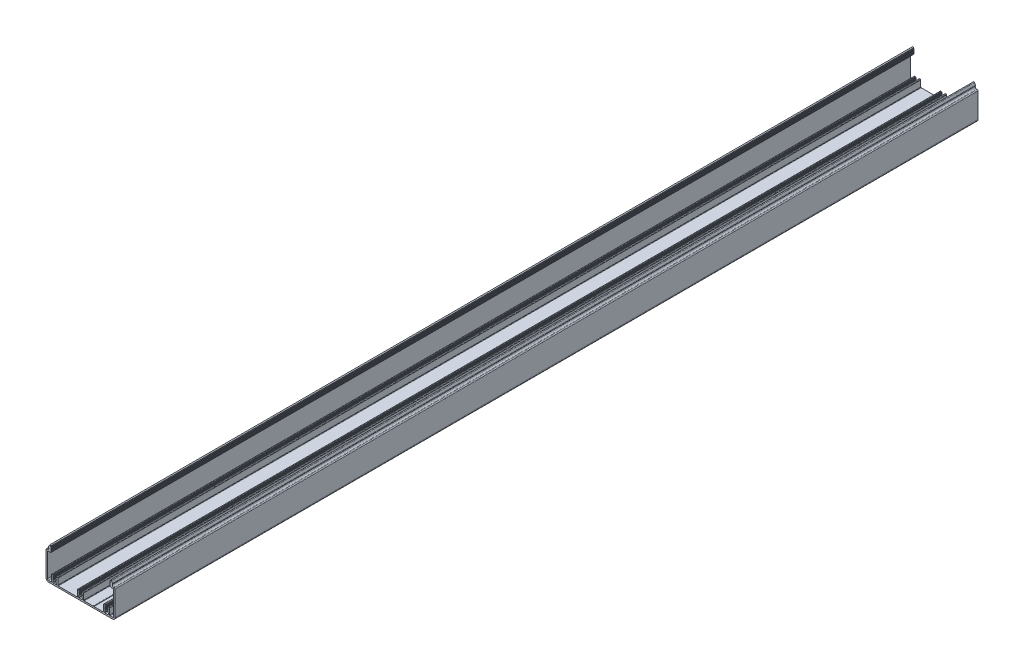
SolidWorks part; units mm, degrees
ref_plane "Ebene vorne" through (0, 0, 0) normal (0, 0, 1) x (1, 0, 0)
ref_plane "Ebene oben" through (0, 0, 0) normal (0, 1, 0) x (1, 0, 0)
ref_plane "Ebene rechts" through (0, 0, 0) normal (1, 0, 0) x (0, 0, -1)
sketch "Model" plane through (0, 0, 0) normal (0, 0, 1) x (1, 0, 0)
  line L0 (137.0091, -31.8859) -> (137.5591, -32.2034)
  line L1 (137.5591, -32.2034) -> (137.5591, -32.9684)
  line L2 (137.5591, -32.9684) -> (137.0091, -33.2859)
  line L3 (137.0091, -33.2859) -> (137.5591, -33.6034)
  line L4 (137.5591, -33.6034) -> (137.5591, -34.3684)
  line L5 (137.5591, -34.3684) -> (137.0091, -34.6859)
  line L6 (137.0091, -34.6859) -> (137.5591, -35.0034)
  line L7 (137.5591, -35.0034) -> (137.5591, -35.7683)
  line L8 (137.5591, -35.7683) -> (137.0091, -36.0859)
  line L9 (137.0091, -36.0859) -> (137.5591, -36.4034)
  line L10 (137.5591, -36.4034) -> (137.5591, -37.1683)
  line L11 (137.5591, -37.1683) -> (137.0091, -37.4859)
  line L12 (137.0091, -37.4859) -> (137.0091, -39.0359)
  line L13 (140.7591, -32.0359) -> (140.7591, -32.2684)
  line L14 (140.7591, -32.2684) -> (141.3091, -32.5859)
  line L15 (141.3091, -32.5859) -> (140.7591, -32.9034)
  line L16 (140.7591, -32.9034) -> (140.7591, -33.6684)
  line L17 (140.7591, -33.6684) -> (141.3091, -33.9859)
  line L18 (141.3091, -33.9859) -> (140.7591, -34.3034)
  line L19 (140.7591, -34.3034) -> (140.7591, -35.0683)
  line L20 (140.7591, -35.0683) -> (141.3091, -35.3859)
  line L21 (141.3091, -35.3859) -> (140.7591, -35.7034)
  line L22 (140.7591, -35.7034) -> (140.7591, -36.4683)
  line L23 (140.7591, -36.4683) -> (141.3091, -36.7859)
  line L24 (141.3091, -36.7859) -> (140.7591, -37.1034)
  line L25 (140.7591, -37.1034) -> (140.7591, -37.8683)
  line L26 (140.7591, -37.8683) -> (141.3091, -38.1859)
  line L27 (141.3091, -38.1859) -> (141.3091, -39.0359)
  line L28 (135.5091, -32.0359) -> (135.5091, -39.0359)
  line L29 (142.8091, -32.0359) -> (142.8091, -39.0359)
  line L30 (136.0091, -31.5359) -> (137.0091, -31.5359)
  line L31 (141.2591, -31.5359) -> (142.3091, -31.5359)
  line L32 (137.0091, -31.8859) -> (137.0091, -31.5359)
  line L33 (107.0091, -31.8859) -> (107.5591, -32.2034)
  line L34 (107.5591, -32.2034) -> (107.5591, -32.9684)
  line L35 (107.5591, -32.9684) -> (107.0091, -33.2859)
  line L36 (107.0091, -33.2859) -> (107.5591, -33.6034)
  line L37 (107.5591, -33.6034) -> (107.5591, -34.3684)
  line L38 (107.5591, -34.3684) -> (107.0091, -34.6859)
  line L39 (107.0091, -34.6859) -> (107.5591, -35.0034)
  line L40 (107.5591, -35.0034) -> (107.5591, -35.7683)
  line L41 (107.5591, -35.7683) -> (107.0091, -36.0859)
  line L42 (107.0091, -36.0859) -> (107.5591, -36.4034)
  line L43 (107.5591, -36.4034) -> (107.5591, -37.1683)
  line L44 (107.5591, -37.1683) -> (107.0091, -37.4859)
  line L45 (107.0091, -37.4859) -> (107.0091, -39.0359)
  line L46 (110.7591, -32.0359) -> (110.7591, -32.2684)
  line L47 (110.7591, -32.2684) -> (111.3091, -32.5859)
  line L48 (111.3091, -32.5859) -> (110.7591, -32.9034)
  line L49 (110.7591, -32.9034) -> (110.7591, -33.6684)
  line L50 (110.7591, -33.6684) -> (111.3091, -33.9859)
  line L51 (111.3091, -33.9859) -> (110.7591, -34.3034)
  line L52 (110.7591, -34.3034) -> (110.7591, -35.0683)
  line L53 (110.7591, -35.0683) -> (111.3091, -35.3859)
  line L54 (111.3091, -35.3859) -> (110.7591, -35.7034)
  line L55 (110.7591, -35.7034) -> (110.7591, -36.4683)
  line L56 (110.7591, -36.4683) -> (111.3091, -36.7859)
  line L57 (111.3091, -36.7859) -> (110.7591, -37.1034)
  line L58 (110.7591, -37.1034) -> (110.7591, -37.8683)
  line L59 (110.7591, -37.8683) -> (111.3091, -38.1859)
  line L60 (111.3091, -38.1859) -> (111.3091, -39.0359)
  line L61 (107.5091, -39.5359) -> (110.8091, -39.5359)
  line L62 (105.5091, -32.0359) -> (105.5091, -39.0359)
  line L63 (112.8091, -32.0359) -> (112.8091, -39.0359)
  line L64 (106.0091, -31.5359) -> (107.0091, -31.5359)
  line L65 (111.2591, -31.5359) -> (112.3091, -31.5359)
  line L66 (107.0091, -31.8859) -> (107.0091, -31.5359)
  line L67 (173.6658, -4.2821) -> (173.6658, -3.7877)
  line L68 (175.0687, -3.4118) -> (176.2252, -5.4148)
  line L69 (177.5091, -8.8359) -> (178.1591, -8.8359)
  line L70 (171.3091, -31.8859) -> (170.7591, -32.2034)
  line L71 (170.7591, -32.2034) -> (170.7591, -32.9684)
  line L72 (170.7591, -32.9684) -> (171.3091, -33.2859)
  line L73 (171.3091, -33.2859) -> (170.7591, -33.6034)
  line L74 (170.7591, -33.6034) -> (170.7591, -34.3684)
  line L75 (170.7591, -34.3684) -> (171.3091, -34.6859)
  line L76 (171.3091, -34.6859) -> (170.7591, -35.0034)
  line L77 (170.7591, -35.0034) -> (170.7591, -35.7683)
  line L78 (170.7591, -35.7683) -> (171.3091, -36.0859)
  line L79 (171.3091, -36.0859) -> (170.7591, -36.4034)
  line L80 (170.7591, -36.4034) -> (170.7591, -37.1683)
  line L81 (170.7591, -37.1683) -> (171.3091, -37.4859)
  line L82 (171.3091, -37.4859) -> (171.3091, -39.0359)
  line L83 (167.5591, -32.0359) -> (167.5591, -32.2684)
  line L84 (167.5591, -32.2684) -> (167.0091, -32.5859)
  line L85 (167.0091, -32.5859) -> (167.5591, -32.9034)
  line L86 (167.5591, -32.9034) -> (167.5591, -33.6684)
  line L87 (167.5591, -33.6684) -> (167.0091, -33.9859)
  line L88 (167.0091, -33.9859) -> (167.5591, -34.3034)
  line L89 (167.5591, -34.3034) -> (167.5591, -35.0683)
  line L90 (167.5591, -35.0683) -> (167.0091, -35.3859)
  line L91 (167.0091, -35.3859) -> (167.5591, -35.7034)
  line L92 (167.5591, -35.7034) -> (167.5591, -36.4683)
  line L93 (167.5591, -36.4683) -> (167.0091, -36.7859)
  line L94 (167.0091, -36.7859) -> (167.5591, -37.1034)
  line L95 (167.5591, -37.1034) -> (167.5591, -37.8683)
  line L96 (167.5591, -37.8683) -> (167.0091, -38.1859)
  line L97 (167.0091, -38.1859) -> (167.0091, -39.0359)
  line L98 (170.8091, -39.5359) -> (167.5091, -39.5359)
  line L99 (172.8091, -32.0359) -> (172.8091, -39.0359)
  line L100 (165.5091, -32.0359) -> (165.5091, -39.0359)
  line L101 (172.3091, -31.5359) -> (171.3091, -31.5359)
  line L102 (167.0591, -31.5359) -> (166.0091, -31.5359)
  line L103 (171.3091, -31.8859) -> (171.3091, -31.5359)
  line L104 (173.66, -9.8864) -> (173.1091, -9.5684)
  line L105 (173.1091, -9.5684) -> (173.1091, -8.8034)
  line L106 (173.1091, -8.8034) -> (173.6591, -8.4859)
  line L107 (173.6591, -8.4859) -> (173.1091, -8.1684)
  line L108 (173.1091, -8.1684) -> (173.1091, -7.4034)
  line L109 (173.1091, -7.4034) -> (173.6591, -7.0859)
  line L110 (173.6591, -7.0859) -> (173.1091, -6.7684)
  line L111 (173.1091, -6.7684) -> (173.1091, -6.0035)
  line L112 (173.1091, -6.0035) -> (173.6591, -5.6859)
  line L113 (173.6591, -5.6859) -> (173.1091, -5.3684)
  line L114 (173.1091, -5.3684) -> (173.1091, -4.6035)
  line L115 (102.1591, -41.3359) -> (176.1591, -41.3359)
  line L116 (99.1591, -9.8359) -> (99.1591, -38.3359)
  line L117 (100.9591, -38.3359) -> (100.9591, -10.8359)
  line L118 (179.1591, -9.8359) -> (179.1591, -38.3359)
  line L119 (177.3591, -38.3359) -> (177.3591, -10.8359)
  line L120 (176.1591, -39.5359) -> (173.3091, -39.5359)
  line L121 (135.0091, -39.5359) -> (113.3091, -39.5359)
  line L122 (105.0091, -39.5359) -> (102.1591, -39.5359)
  line L123 (104.6582, -9.8864) -> (105.2091, -9.5684)
  line L124 (105.2091, -9.5684) -> (105.2091, -8.8034)
  line L125 (105.2091, -8.8034) -> (104.6591, -8.4859)
  line L126 (104.6591, -8.4859) -> (105.2091, -8.1684)
  line L127 (105.2091, -8.1684) -> (105.2091, -7.4034)
  line L128 (105.2091, -7.4034) -> (104.6591, -7.0859)
  line L129 (104.6591, -7.0859) -> (105.2091, -6.7684)
  line L130 (105.2091, -6.7684) -> (105.2091, -6.0034)
  line L131 (105.2091, -6.0034) -> (104.6591, -5.6859)
  line L132 (104.6591, -5.6859) -> (105.2091, -5.3684)
  line L133 (105.2091, -5.3684) -> (105.2091, -4.6034)
  line L134 (105.2091, -4.6034) -> (104.6525, -4.2821)
  line L135 (104.6582, -9.8864) -> (104.658, -10.3359)
  line L136 (104.658, -10.3359) -> (101.4591, -10.3359)
  line L137 (173.66, -9.8864) -> (173.6602, -10.3359)
  line L138 (173.6602, -10.3359) -> (176.8591, -10.3359)
  line L139 (104.6525, -4.2821) -> (104.6525, -3.7877)
  line L140 (103.2495, -3.4118) -> (102.0931, -5.4148)
  line L141 (100.8091, -8.8359) -> (100.1591, -8.8359)
  line L142 (173.1091, -4.6035) -> (173.6658, -4.2821)
  line L143 (137.5091, -39.5359) -> (140.8091, -39.5359)
  line L144 (143.3091, -39.5359) -> (153.8127, -39.5359)
  line L145 (154.5055, -39.5359) -> (165.0091, -39.5359)
  arc A0 (137.0091, -39.0359) -> (137.5091, -39.5359) centre (137.5091, -39.0359) ccw
  arc A1 (140.8091, -39.5359) -> (141.3091, -39.0359) centre (140.8091, -39.0359) ccw
  arc A2 (135.0091, -39.5359) -> (135.5091, -39.0359) centre (135.0091, -39.0359) ccw
  arc A3 (142.8091, -32.0359) -> (142.3091, -31.5359) centre (142.3091, -32.0359) ccw
  arc A4 (142.8091, -39.0359) -> (143.3091, -39.5359) centre (143.3091, -39.0359) ccw
  arc A5 (136.0091, -31.5359) -> (135.5091, -32.0359) centre (136.0091, -32.0359) ccw
  arc A6 (141.2591, -31.5359) -> (140.7591, -32.0359) centre (141.2591, -32.0359) ccw
  arc A7 (107.0091, -39.0359) -> (107.5091, -39.5359) centre (107.5091, -39.0359) ccw
  arc A8 (110.8091, -39.5359) -> (111.3091, -39.0359) centre (110.8091, -39.0359) ccw
  arc A9 (105.0091, -39.5359) -> (105.5091, -39.0359) centre (105.0091, -39.0359) ccw
  arc A10 (112.8091, -32.0359) -> (112.3091, -31.5359) centre (112.3091, -32.0359) ccw
  arc A11 (112.8091, -39.0359) -> (113.3091, -39.5359) centre (113.3091, -39.0359) ccw
  arc A12 (106.0091, -31.5359) -> (105.5091, -32.0359) centre (106.0091, -32.0359) ccw
  arc A13 (111.2591, -31.5359) -> (110.7591, -32.0359) centre (111.2591, -32.0359) ccw
  arc A14 (176.2023, -6.4525) -> (176.2252, -5.4148) centre (175.3591, -5.9148) ccw
  arc A15 (176.2023, -6.4525) -> (177.5091, -8.8359) centre (177.5091, -7.2859) ccw
  arc A16 (179.1591, -9.8359) -> (178.1591, -8.8359) centre (178.1591, -9.8359) ccw
  arc A17 (170.8091, -39.5359) -> (171.3091, -39.0359) centre (170.8091, -39.0359) ccw
  arc A18 (167.0091, -39.0359) -> (167.5091, -39.5359) centre (167.5091, -39.0359) ccw
  arc A19 (172.8091, -39.0359) -> (173.3091, -39.5359) centre (173.3091, -39.0359) ccw
  arc A20 (166.0091, -31.5359) -> (165.5091, -32.0359) centre (166.0091, -32.0359) ccw
  arc A21 (165.0091, -39.5359) -> (165.5091, -39.0359) centre (165.0091, -39.0359) ccw
  arc A22 (172.8091, -32.0359) -> (172.3091, -31.5359) centre (172.3091, -32.0359) ccw
  arc A23 (167.5591, -32.0359) -> (167.0591, -31.5359) centre (167.0591, -32.0359) ccw
  arc A24 (100.9591, -38.3359) -> (102.1591, -39.5359) centre (102.1591, -38.3359) ccw
  arc A25 (101.4591, -10.3359) -> (100.9591, -10.8359) centre (101.4591, -10.8359) ccw
  arc A26 (176.1591, -39.5359) -> (177.3591, -38.3359) centre (176.1591, -38.3359) ccw
  arc A27 (177.3591, -10.8359) -> (176.8591, -10.3359) centre (176.8591, -10.8359) ccw
  arc A28 (99.1591, -38.3359) -> (102.1591, -41.3359) centre (102.1591, -38.3359) ccw
  arc A29 (176.1591, -41.3359) -> (179.1591, -38.3359) centre (176.1591, -38.3359) ccw
  arc A30 (102.0931, -5.4148) -> (102.116, -6.4525) centre (102.9591, -5.9148) ccw
  arc A31 (100.8091, -8.8359) -> (102.116, -6.4525) centre (100.8091, -7.2859) ccw
  arc A32 (100.1591, -8.8359) -> (99.1591, -9.8359) centre (100.1591, -9.8359) ccw
  arc A33 (175.0687, -3.4118) -> (173.6658, -3.7877) centre (174.4176, -3.7877) ccw
  arc A34 (104.6525, -3.7877) -> (103.2495, -3.4118) centre (103.9006, -3.7877) ccw
  arc A35 (154.5055, -39.5359) -> (153.8127, -39.5359) centre (154.1591, -39.5859) ccw
extrude "Aufsatz-Linear austragen1" add sketch "Model" along normal blind 1000
